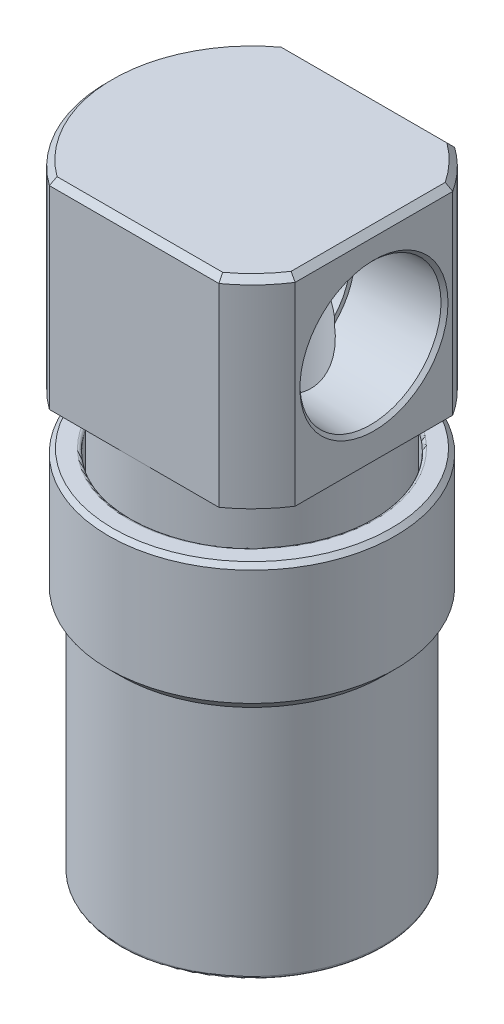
SolidWorks part; units mm, degrees
ref_plane "Front Plane" through (0, 0, 0) normal (0, 0, 1) x (1, 0, 0)
ref_plane "Top Plane" through (0, 0, 0) normal (0, 1, 0) x (1, 0, 0)
ref_plane "Right Plane" through (0, 0, 0) normal (1, 0, 0) x (0, 0, -1)
imported_body "SC200S"
imported_body "BODY"
imported_body "SLEEVE"
other "DeleteFace3"
sketch "Sketch1" plane through (0, 0, 0) normal (0, 0, 1) x (1, 0, 0)
  line L1 (7.36, 51.1221) -> (-7.36, 51.1221)
  line L2 (7.36, 51.1221) -> (7.36, 36.7619)
  line L3 (7.36, 36.7619) -> (-7.36, 36.7619)
  line L4 (-7.36, 51.1221) -> (-7.36, 36.7619)
  line L5 (7.36, 51.1221) -> (-7.36, 36.7619) construction
  line L6 (7.36, 36.7619) -> (-7.36, 51.1221) construction
  point P0 (0, 43.942)
extrude "Boss-Extrude1" add sketch "Sketch1" along normal up to surface and the other way up to surface
sketch "Sketch6" plane through (0, 53.975, 0) normal (0, 1, 0) x (1, 0, 0)
  circle A0 centre (0, 0) radius 10.3124
  dimension "D1" = 20.6248
extrude "Cut-Extrude2" cut sketch "Sketch6" against normal blind 25.4 flip side to cut
sketch "Sketch2" plane through (0, 53.975, 0) normal (0, 1, 0) x (1, 0, 0)
  line L0 (-6.3457, 0) -> (16.4838, 0) construction
  line L1 (-7.4124, 10.3124) -> (7.4124, 10.3124)
  line L3 (-7.4124, -10.3124) -> (7.4124, -10.3124)
  line L4 (10.668, 6.8908) -> (10.668, -6.8908)
  line L5 (-8.9278, 9.0324) -> (8.9278, -9.0324) construction
  line L6 (-8.9278, -9.0324) -> (8.9278, 9.0324) construction
  arc A0 (-7.4124, 10.3124) -> (-7.4124, -10.3124) centre (0, 0) ccw
  arc A1 (7.4124, -10.3124) -> (10.668, -6.8908) centre (0, 0) ccw
  arc A2 (10.668, 6.8908) -> (7.4124, 10.3124) centre (0, 0) ccw
  dimension "D1" = 12.7
  dimension "D2" = 20.6248
  dimension "D3" = 10.668
extrude "Boss-Extrude2" add sketch "Sketch2" against normal blind 17.4625
hole_wizard "1/4 NPT Tapped Hole1" positions "Sketch3" profile "Sketch4" size "1/4" standard "ANSI Inch"
sketch "Sketch3" plane through (10.668, 0, 0) normal (1, 0, 0) x (0, 0, -1)
  line L0 (-6.8908, 53.975) -> (6.8908, 53.975) construction
  point P0 (0, 45.2437)
  dimension "D1" = 8.7312
sketch "Sketch4" plane through (10.668, 45.2437, 0) normal (0, 1, 0) x (0, 0, -1)
  line L0 (0, 0) -> (0, 19.2173)
  line L1 (5.5626, 15.875) -> (0, 19.2173)
  line L2 (-5.5626, 15.875) -> (0, 19.2173) construction
  line L3 (5.5626, 15.875) -> (5.5626, 7.62)
  line L4 (5.5626, 7.62) -> (5.9528, 7.62)
  line L5 (5.9528, 7.62) -> (6.1718, 0.3052)
  line L6 (6.1718, 0.3052) -> (6.477, 0)
  line L7 (6.477, 0) -> (0, 0)
  line L8 (0, -6.35) -> (0, 107.95) construction
  line L9 (-6.1718, 0.3052) -> (-6.477, 0) construction
  line L11 (-5.5626, 7.62) -> (-5.9528, 7.62) construction
  line L12 (-5.9528, 7.62) -> (-6.1718, 0.3052) construction
  dimension "Tap Drill Dia." = 11.1252
  dimension "Tap Drill Depth" = 15.875
  dimension "Thread Dia." = 12.3437
  dimension "Thread Angle" = 3.43
  dimension "Thread Depth" = 7.62
  dimension "C'Sink Dia." = 12.954
  dimension "C'Sink Angle" = 90
  dimension "Drill Angle" = 118
sketch "Sketch5" plane through (0, 36.5125, 0) normal (0, -1, 0) x (1, 0, 0)
  circle A1 centre (0, 0) radius 5.1562
  circle A2 centre (0, 0) radius 5.1562
  dimension "D1" = 0
extrude "Cut-Extrude1" cut sketch "Sketch5" against normal blind 7.9375
chamfer "Chamfer1" distance 0.508 angle 45 6 edges at (0, 53.975, -10.3124) (9.2007, 53.975, -8.7543) (10.668, 53.975, 0) (9.2007, 53.975, 8.7543) (0, 53.975, 10.3124) (-12.7, 53.975, 0)
